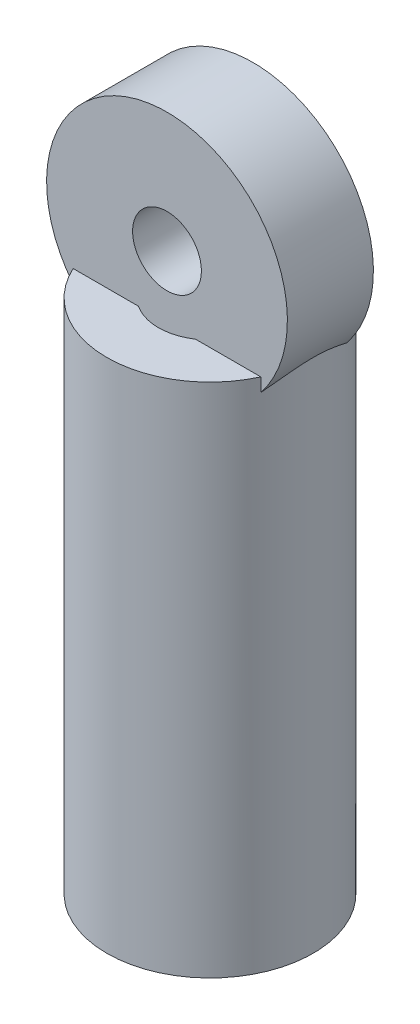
SolidWorks part; units mm, degrees
ref_plane "Front Plane" through (0, 0, 0) normal (0, 0, 1) x (1, 0, 0)
ref_plane "Top Plane" through (0, 0, 0) normal (0, 1, 0) x (1, 0, 0)
ref_plane "Right Plane" through (0, 0, 0) normal (1, 0, 0) x (0, 0, -1)
sketch "Sketch1" plane through (0, 0, 0) normal (0, 0, 1) x (1, 0, 0)
  circle A0 centre (0, 0) radius 2
  circle A1 centre (0, 0) radius 7
  dimension "D1" = 4
  dimension "D2" = 14
extrude "Boss-Extrude1" add sketch "Sketch1" along normal mid plane 5
sketch "Sketch2" plane through (0, 0, 0) normal (0, 0, 1) x (1, 0, 0)
  line L0 (0, 0) -> (0, -20.842) construction
  line L1 (3, -3.6056) -> (3, -33.6056)
  line L2 (3, -33.6056) -> (6, -33.6056)
  line L3 (6, -33.6056) -> (6, -3.6056)
  line L4 (6, -3.6056) -> (3, -3.6056)
  circle A0 centre (0, 0) radius 7 construction
  dimension "D1" = 3
  dimension "D2" = 3
  dimension "D3" = 30
revolve "Revolve1" add sketch "Sketch2" angle 360 about L0
